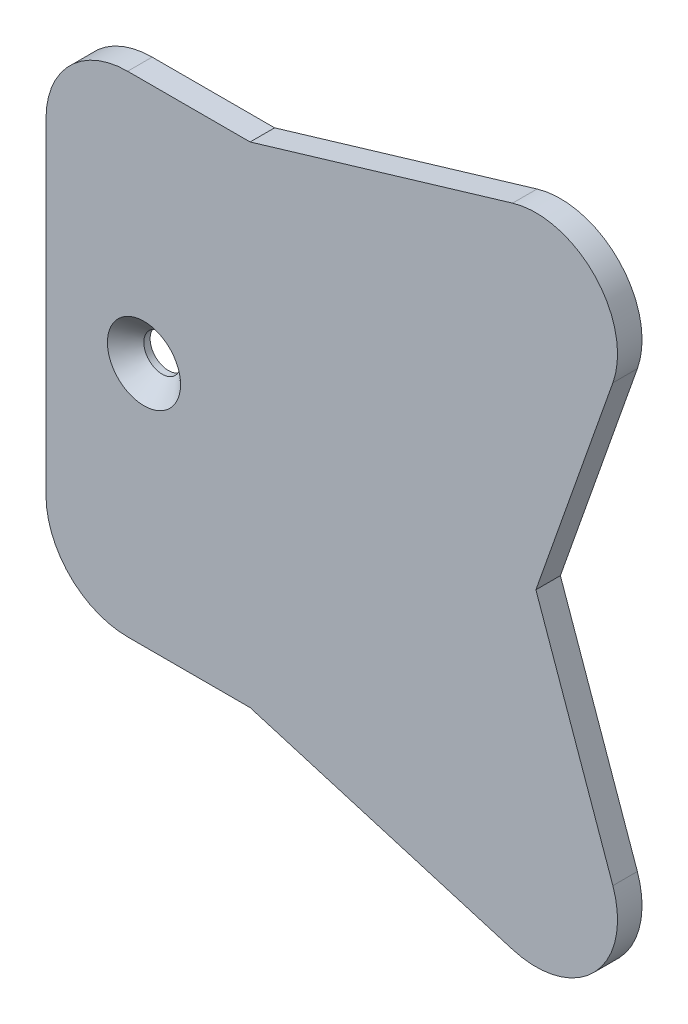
SolidWorks part; units mm, degrees
ref_plane "Front Plane" through (0, 0, 0) normal (0, 0, 1) x (1, 0, 0)
ref_plane "Top Plane" through (0, 0, 0) normal (0, 1, 0) x (1, 0, 0)
ref_plane "Right Plane" through (0, 0, 0) normal (1, 0, 0) x (0, 0, -1)
sketch "Sketch1" plane through (0, 0, 0) normal (0, 0, 1) x (1, 0, 0)
  line L0 (0, 0) -> (60, 0) construction
  line L1 (0, -20) -> (0, 20)
  line L2 (10, 30) -> (25, 30)
  line L3 (25, 30) -> (57.1429, 39.5831)
  line L4 (69.4281, 26.6667) -> (60, 0)
  line L5 (69.4281, -26.6667) -> (60, 0)
  line L6 (25, -30) -> (57.1429, -39.5831)
  line L7 (10, -30) -> (25, -30)
  arc A0 (0, 20) -> (10, 30) centre (10, 20) cw
  arc A1 (69.4281, 26.6667) -> (57.1429, 39.5831) centre (60, 30) ccw
  arc A2 (69.4281, -26.6667) -> (57.1429, -39.5831) centre (60, -30) cw
  arc A3 (0, -20) -> (10, -30) centre (10, -20) ccw
  dimension "D1" = 10
  dimension "D2" = 10
  dimension "D3" = 20
  dimension "D4" = 30
  dimension "D5" = 25
  dimension "D6" = 35
  dimension "D7" = 60
base flange "Base-Flange1" sketch "Sketch1" thickness 3 reverse thickness direction no parameters "D1"=0.5
sketch "Sketch6" plane through (0, 0, 0) normal (0, 0, 1) x (1, 0, 0)
  line L0 (0, 0) -> (60, 0) construction
  line L1 (0, 20) -> (0, -20) construction
  point P4 (12, 0)
  dimension "D1" = 12
hole_wizard "CSK for M4 Hex Socket Countersunk Cap Screw1" positions "Sketch8" profile "Sketch7" countersink size "M4" standard "ISO"
sketch "Sketch8" plane through (0, 0, 0) normal (0, 0, 1) x (1, 0, 0)
  point P0 (12, 0)
sketch "Sketch7" plane through (12, 0, 0) normal (1, 0, 0) x (0, -1, 0)
  line L0 (0, 0) -> (0, 3)
  line L1 (0, 3) -> (2.25, 3)
  line L2 (2.25, 3) -> (2.25, 2.23)
  line L3 (2.25, 2.23) -> (4.48, 0)
  line L5 (4.48, 0) -> (0, 0)
  line L6 (-2.25, 2.23) -> (-4.48, 0) construction
  line L11 (0, -6.35) -> (0, 107.95) construction
  dimension "Thru Hole Dia." = 4.5
  dimension "Thru Hole Depth" = 3
  dimension "Near C'Sink Dia." = 8.96
  dimension "Near C'Sink Angle" = 90
sketch "Bend-Lines1" [suppressed] plane through (0, 0, 0) normal (0, 1, 0) x (1, 0, 0)
sketch "Bounding-Box1" [suppressed] plane through (0, 0, 0) normal (0, 1, 0) x (1, 0, 0)
sheet metal parameters "Sheet-Metal1" thickness 3 parameters "D1"=0.5
flat pattern "Flat-Pattern1"
sketch "Bend-Lines2" plane through (0, 0, 0) normal (0, 1, 0) x (1, 0, 0)
sketch3d "Bounding-Box2" [suppressed]
  line L0 (10, -70, 0) -> (10, 10, 0) construction
  line L1 (-60, -70, 0) -> (-60, 10, 0) construction
  line L2 (10, -70, 0) -> (-60, -70, 0) construction
  line L3 (10, 10, 0) -> (-60, 10, 0) construction
sheet metal parameters "Sheet-Metal2" thickness 3 parameters "D1"=0.5
flat pattern "Flat-Pattern1"
sketch "Bend-Lines2" plane through (0, 0, 0) normal (0, 1, 0) x (1, 0, 0)
sketch3d "Bounding-Box2" [suppressed]
  line L0 (10, -70, 0) -> (10, 10, 0) construction
  line L1 (-60, -70, 0) -> (-60, 10, 0) construction
  line L2 (10, -70, 0) -> (-60, -70, 0) construction
  line L3 (10, 10, 0) -> (-60, 10, 0) construction
